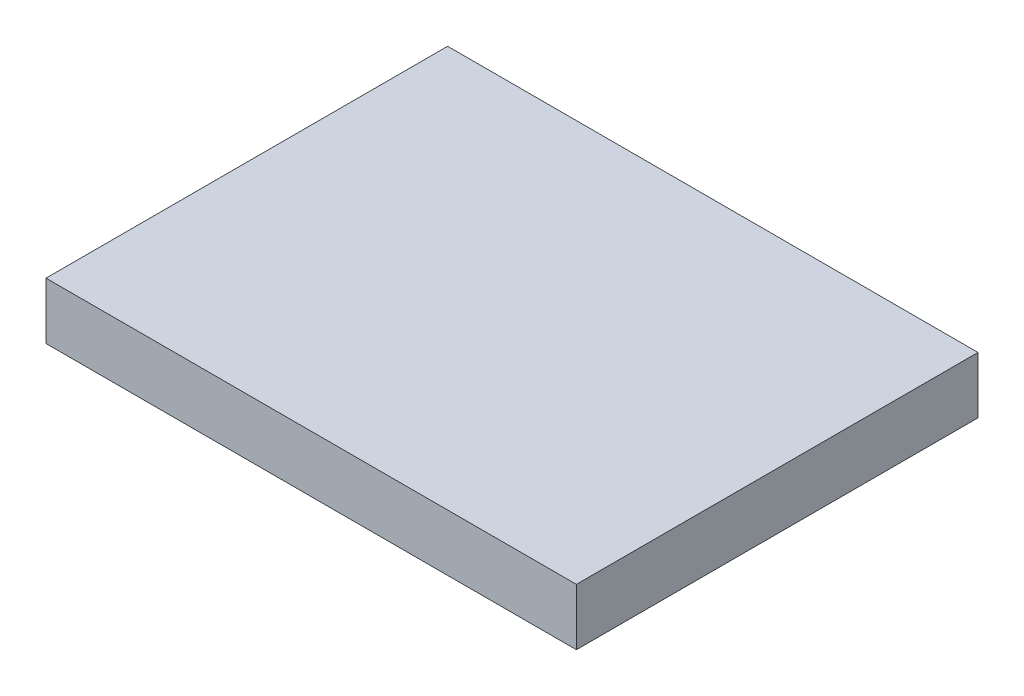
SolidWorks part; units mm, degrees
ref_plane "Plano frontal" through (0, 0, 0) normal (0, 0, 1) x (1, 0, 0)
ref_plane "Plano superior" through (0, 0, 0) normal (0, 1, 0) x (1, 0, 0)
ref_plane "Plano direito" through (0, 0, 0) normal (1, 0, 0) x (0, 0, -1)
sketch "Esboço1" plane through (0, 0, 0) normal (0, 1, 0) x (1, 0, 0)
  line L1 (-103, -78) -> (103, -78)
  line L2 (-103, -78) -> (-103, 78)
  line L3 (-103, 78) -> (103, 78)
  line L4 (103, -78) -> (103, 78)
  line L5 (-103, -78) -> (103, 78) construction
  line L6 (-103, 78) -> (103, -78) construction
  point P0 (0, 0)
  dimension "D1" = 206
  dimension "D2" = 156
extrude "Extrusão1" add sketch "Esboço1" along normal blind 22
